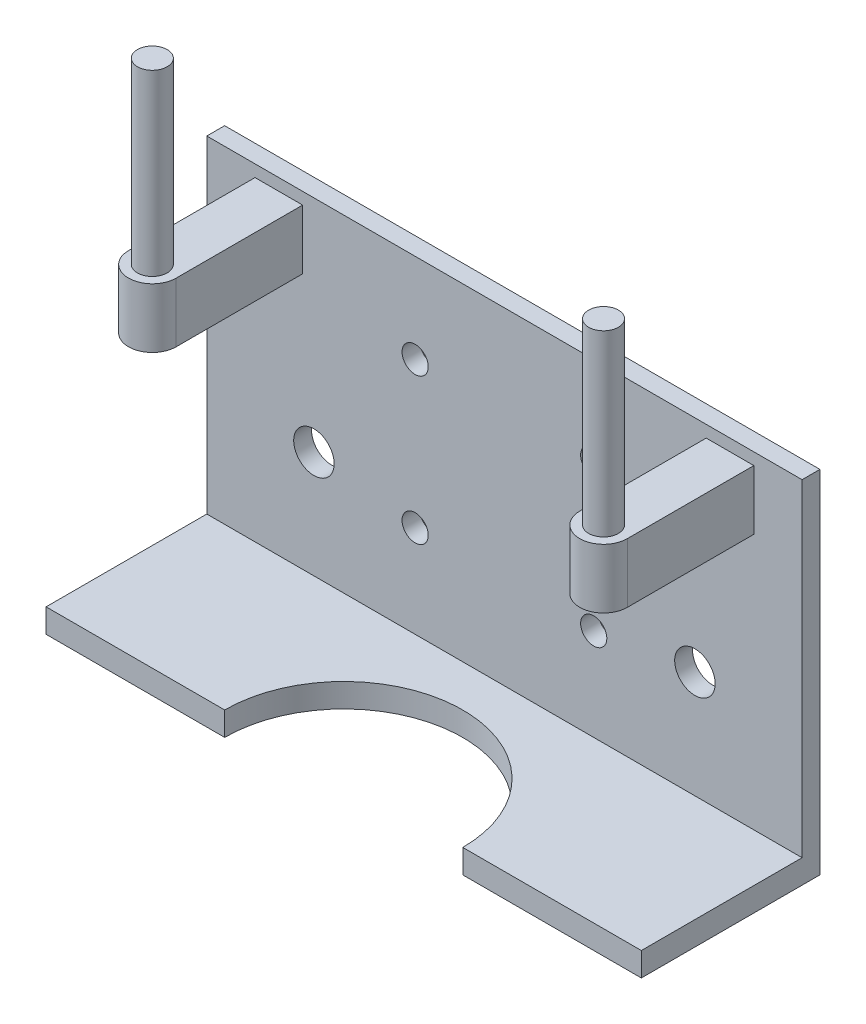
SolidWorks part; units mm, degrees
ref_plane "前视基准面" through (0, 0, 0) normal (0, 0, 1) x (1, 0, 0)
ref_plane "上视基准面" through (0, 0, 0) normal (0, 1, 0) x (1, 0, 0)
ref_plane "右视基准面" through (0, 0, 0) normal (1, 0, 0) x (0, 0, -1)
sketch "草图1" plane through (0, 0, 0) normal (0, 0, 1) x (1, 0, 0)
  line L1 (50, 27.5) -> (-50, 27.5)
  line L2 (50, 27.5) -> (50, -27.5)
  line L3 (50, -27.5) -> (-50, -27.5)
  line L4 (-50, 27.5) -> (-50, -27.5)
  line L5 (50, 27.5) -> (-50, -27.5) construction
  line L6 (50, -27.5) -> (-50, 27.5) construction
  point P0 (0, 0)
  dimension "D1" = 55
  dimension "D2" = 100
extrude "凸台-拉伸1" add sketch "草图1" along normal blind 3
sketch "草图2" plane through (0, -27.5, 0) normal (0, -1, 0) x (1, 0, 0)
  line L1 (-50, 0) -> (50, 0)
  line L2 (-50, 0) -> (-50, 30)
  line L3 (-50, 30) -> (50, 30)
  line L4 (50, 0) -> (50, 30)
  dimension "D1" = 100
  dimension "D2" = 30
extrude "凸台-拉伸2" add sketch "草图2" along normal blind 4
sketch "草图3" plane through (0, 27.5, 0) normal (0, 1, 0) x (1, 0, 0)
  line L0 (37.9, -3) -> (37.9, -24.25) construction
  line L1 (-50, -3) -> (50, -3) construction
  line L2 (41.9, -3) -> (41.9, -24.25)
  line L3 (33.9, -3) -> (33.9, -24.25)
  line L4 (41.9, -3) -> (33.9, -3)
  arc A0 (41.9, -3) -> (33.9, -3) centre (37.9, -3) ccw
  arc A1 (33.9, -24.25) -> (41.9, -24.25) centre (37.9, -24.25) ccw
  point P4 (37.9, -13.625)
  dimension "D2" = 4
  dimension "D1" = 37.9
  dimension "D3" = 21.25
extrude "凸台-拉伸3" add sketch "草图3" against normal blind 10 from offset 2
sketch "草图4" plane through (0, 25.5, 0) normal (0, 1, 0) x (1, 0, 0)
  circle A0 centre (37.9, -24.25) radius 2.5
  dimension "D1" = 5
extrude "凸台-拉伸4" add sketch "草图4" along normal blind 30
mirror "镜向1" about plane through (0, 0, 0) normal (1, 0, 0) of "凸台-拉伸4", "凸台-拉伸3"
sketch "草图5" plane through (0, 27.5, 0) normal (0, 1, 0) x (1, 0, 0)
  line L0 (0, -3) -> (0, -27.005) construction
  line L1 (50, -3) -> (-50, -3) construction
  line L2 (5, -3) -> (5, -27.005)
  line L3 (-5, -3) -> (-5, -27.005)
  line L4 (5, -3) -> (-5, -3)
  arc A0 (5, -3) -> (-5, -3) centre (0, -3) ccw
  arc A1 (-5, -27.005) -> (5, -27.005) centre (0, -27.005) ccw
  circle A2 centre (-37.9, -24.25) radius 18
  point P5 (0, -15.0025)
  dimension "D1" = 5
  dimension "D2" = 36
  dimension "D3" = 38
sketch "草图8" plane through (0, 0, 3) normal (0, 0, 1) x (1, 0, 0)
  line L0 (-50, -9.5) -> (-32, -9.5) construction
  line L1 (-50, 27.5) -> (-50, -27.5) construction
  line L2 (50, -9.5) -> (32, -9.5) construction
  line L3 (50, -27.5) -> (50, 27.5) construction
  line L5 (50, 27.5) -> (-50, 27.5) construction
  dimension "D1" = 18
  dimension "D2" = 18
  dimension "D3" = 37
hole_wizard "M8 螺纹孔1" positions "3D草图1" profile "草图9" tap size "M8" standard "GB"
sketch3d "3D草图1"
  point P0 (-32, -9.5, 3)
  point P3 (32, -9.5, 3)
sketch "草图9" plane through (-32, -9.5, 3) normal (1, 0, 0) x (0, -1, 0)
  line L0 (0, 0) -> (0, 24.5429)
  line L1 (0, 24.5429) -> (3.4, 22.5)
  line L2 (3.4, 22.5) -> (3.4, 0)
  line L5 (3.4, 0) -> (0, 0)
  line L10 (0, 24.5429) -> (-3.4, 22.5) construction
  line L11 (0, -6.35) -> (0, 107.95) construction
  dimension "螺纹孔钻头直径" = 6.8
  dimension "螺纹孔钻头深度" = 22.5
  dimension "导头角度" = 118
sketch "草图11" plane through (0, -31.5, 0) normal (0, -1, 0) x (1, 0, 0)
  line L0 (50, 30) -> (-50, 30) construction
  circle A0 centre (0, 30) radius 20
  dimension "D1" = 40
extrude "切除-拉伸1" cut sketch "草图11" against normal blind 10
sketch "草图12" plane through (0, 0, 3) normal (0, 0, 1) x (1, 0, 0)
  line L0 (0, -27.5) -> (0, -12) construction
  line L2 (-50, -27.5) -> (50, -27.5) construction
  line L3 (0, -12) -> (-15, -12) construction
  line L4 (-15, -12) -> (-15, 12.5) construction
  circle A0 centre (-15, -12) radius 2.2
  circle A1 centre (-15, 12.5) radius 2.2
  dimension "D4" = 4.4
  dimension "D5" = 4.4
  dimension "D1" = 15.5
  dimension "D2" = 15
  dimension "D3" = 24.5
extrude "切除-拉伸2" cut sketch "草图12" against normal blind 10
mirror "镜向2" about plane through (0, 0, 0) normal (1, 0, 0) of "切除-拉伸2"
